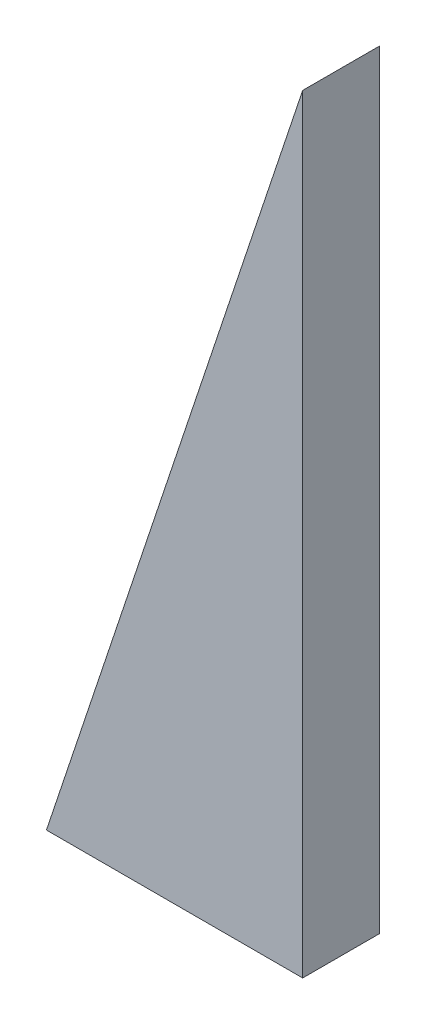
SolidWorks part; units mm, degrees
ref_plane "Plan de face" through (0, 0, 0) normal (0, 0, 1) x (1, 0, 0)
ref_plane "Plan de dessus" through (0, 0, 0) normal (0, 1, 0) x (1, 0, 0)
ref_plane "Plan de droite" through (0, 0, 0) normal (1, 0, 0) x (0, 0, -1)
sketch "Esquisse1" plane through (0, 0, 0) normal (0, 0, 1) x (1, 0, 0)
  line L0 (0, 0) -> (10, 0)
  line L1 (10, 0) -> (10, 30)
  line L2 (10, 30) -> (0, 0)
  dimension "D1" = 10
  dimension "D2" = 30
extrude "Boss.-Extru.1" add sketch "Esquisse1" along normal blind 3
